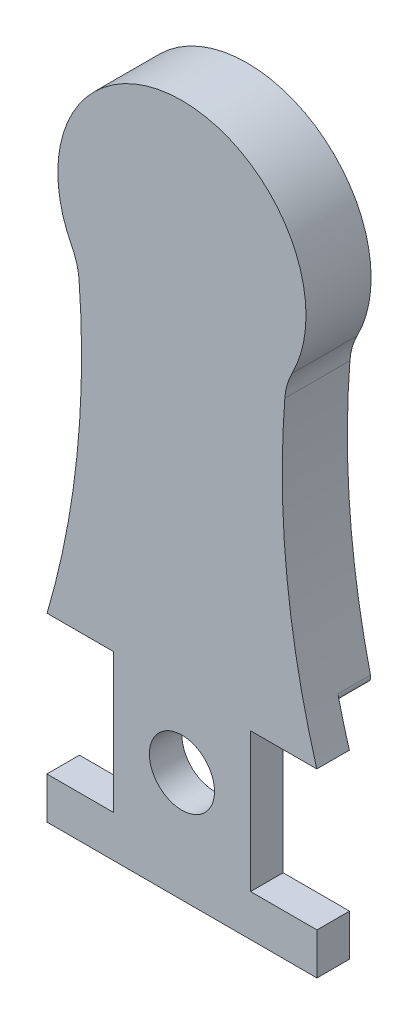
SolidWorks part; units mm, degrees
ref_plane "Front Plane" through (0, 0, 0) normal (0, 0, 1) x (1, 0, 0)
ref_plane "Top Plane" through (0, 0, 0) normal (0, 1, 0) x (1, 0, 0)
ref_plane "Right Plane" through (0, 0, 0) normal (1, 0, 0) x (0, 0, -1)
sketch "Sketch1" plane through (0, 0, 0) normal (0, 0, 1) x (1, 0, 0)
  line L0 (0, 0) -> (0, 60) construction
  line L1 (-53.033, -53.033) -> (0, 0) construction
  line L2 (0, 60) -> (16, 60) construction
  line L3 (0, 60) -> (0, 50) construction
  line L4 (0, 60) -> (-16, 60) construction
  line L5 (0, 0) -> (0, -95.7808) construction
  line L6 (0, 0) -> (53.033, -53.033) construction
  line L8 (-64.561, -58.9899) -> (67.8775, -58.9899) construction
  line L9 (-20.9932, 10.8458) -> (-10.5429, 10.8458) construction
  line L10 (-10.5429, 10.8458) -> (-10.5429, -10.5429) construction
  line L11 (-10.5429, -10.5429) -> (-20.7412, -10.5429) construction
  line L12 (-20.7412, -10.5429) -> (-20.7412, -16.9424) construction
  line L13 (20.7412, -10.5429) -> (20.7412, -16.9424) construction
  line L14 (10.5429, -10.5429) -> (20.7412, -10.5429) construction
  line L15 (10.5429, 10.8458) -> (10.5429, -10.5429) construction
  line L16 (20.9932, 10.8458) -> (10.5429, 10.8458) construction
  line L17 (-20.7412, -16.9424) -> (20.7412, -16.9424) construction
  line L18 (-63.2289, -53.033) -> (63.2289, -53.033) construction
  line L19 (0, 0) -> (-57.4533, -48.2091) construction
  line L20 (0, 0) -> (57.4533, -48.2091) construction
  circle A0 centre (0, 0) radius 5 construction
  arc A1 (-57.4533, -48.2091) -> (-16, 60) centre (-145.6998, 47.6415) ccw
  arc A2 (57.4533, -48.2091) -> (16, 60) centre (145.6998, 47.6415) cw
  arc A3 (-16, 60) -> (16, 60) centre (0, 70.3554) cw
  arc A5 (57.4533, -48.2091) -> (-57.4533, -48.2091) centre (0, 0) cw
  point P20 (0, -106.066)
  dimension "D1" = 10
  dimension "D2" = 75
  dimension "D3" = 60
  dimension "D4" = 5
  dimension "D5" = 5
  dimension "D6" = 41.4824
  dimension "D7" = 21.3887
  dimension "D8" = 6.3996
  dimension "D9" = 21.0858
  dimension "D10" = 6.3995
extrude "Body" add sketch "Sketch1" along normal blind 10
sketch "Sketch2" plane through (0, 0, 10) normal (0, 0, 1) x (1, 0, 0)
  circle A0 centre (0, 0) radius 5
  dimension "D1" = 10
extrude "Attachment Hole" cut sketch "Sketch2" against normal through all
sketch "Sketch17" plane through (0, 0, 10) normal (0, 0, 1) x (1, 0, 0)
  line L0 (-20.9932, 10.8458) -> (-10.5429, 10.8458)
  line L1 (-10.5429, 10.8458) -> (-10.5429, -10.5429)
  line L2 (-10.5429, -10.5429) -> (-20.7412, -10.5429)
  line L3 (-20.7412, -10.5429) -> (-20.7412, -16.9424)
  line L4 (-20.7412, -16.9424) -> (20.7412, -16.9424)
  line L5 (20.7412, -16.9424) -> (20.7412, -10.5429)
  line L6 (20.7412, -10.5429) -> (10.5429, -10.5429)
  line L7 (10.5429, -10.5429) -> (10.5429, 10.8458)
  line L8 (10.5429, 10.8458) -> (20.9932, 10.8458)
  line L9 (0, 0) -> (0, 42.2888) construction
  line L10 (0, 0) -> (0, 60) construction
  line L11 (0, 36.1313) -> (0, -16.9424) construction
  arc A0 (-20.9932, 10.8458) -> (-20.1377, 12.8717) centre (-168.3354, 74.256) ccw
  arc A2 (20.9932, 10.8458) -> (20.1377, 12.8717) centre (168.3354, 74.256) cw
  arc A3 (-20.1377, 12.8717) -> (20.1377, 12.8717) centre (0, 0) cw
  arc A4 (16, 60) -> (57.4533, -48.2091) centre (145.6998, 47.6415) ccw construction
  dimension "D2" = 23.9
  dimension "D1" = 53.0738
sketch "Sketch34" plane through (0, 0, 10) normal (0, 0, 1) x (1, 0, 0)
  line L0 (-20.9932, 10.8458) -> (-10.5429, 10.8458)
  line L1 (-10.5429, 10.8458) -> (-10.5429, -10.5429)
  line L2 (-10.5429, -10.5429) -> (-20.7412, -10.5429)
  line L3 (-20.7412, -10.5429) -> (-20.7412, -16.9424)
  line L4 (-20.7412, -16.9424) -> (20.7412, -16.9424)
  line L5 (20.7412, -16.9424) -> (20.7412, -10.5429)
  line L6 (20.7412, -10.5429) -> (10.5429, -10.5429)
  line L7 (10.5429, -10.5429) -> (10.5429, 10.8458)
  line L8 (10.5429, 10.8458) -> (20.9932, 10.8458)
  arc A0 (-20.9932, 10.8458) -> (-57.4533, -48.2091) centre (-148.4496, 48.754) cw
  arc A1 (-57.4533, -48.2091) -> (57.4533, -48.2091) centre (0, 0) ccw
  arc A2 (57.4533, -48.2091) -> (20.9932, 10.8458) centre (209.9801, 86.7426) cw
extrude "Cut-Extrude28" cut sketch "Sketch34" against normal through all
sketch "Sketch35" plane through (0, 0, 0) normal (0, 0, -1) x (-1, 0, 0)
  line L0 (20.9932, 10.8458) -> (10.5429, 10.8458)
  line L1 (10.5429, 10.8458) -> (10.5429, -10.5429)
  line L2 (10.5429, -10.5429) -> (20.7412, -10.5429)
  line L3 (20.7412, -10.5429) -> (20.7412, -16.9424)
  line L4 (20.7412, -16.9424) -> (-20.7412, -16.9424)
  line L5 (-20.7412, -16.9424) -> (-20.7412, -10.5429)
  line L6 (-20.7412, -10.5429) -> (-10.5429, -10.5429)
  line L7 (-10.5429, -10.5429) -> (-10.5429, 10.8458)
  line L8 (-10.5429, 10.8458) -> (-20.9932, 10.8458)
  arc A0 (-20.1377, 12.8717) -> (20.1377, 12.8717) centre (0, 0) cw
  arc A1 (-20.9932, 10.8458) -> (-20.1377, 12.8717) centre (-171.8915, 75.7576) ccw
  arc A2 (20.1377, 12.8717) -> (20.9932, 10.8458) centre (149.3848, 66.2539) ccw
  arc A3 (16, 60) -> (20.7164, 10.8458) centre (145.6998, 47.6415) ccw construction
  arc A4 (-20.7164, 10.8458) -> (-16, 60) centre (-145.6998, 47.6415) ccw construction
  dimension "D1" = 23.9
extrude "Cut-Extrude30" cut sketch "Sketch35" against normal blind 5
fillet "Fillet1" radius 10 1 edges at (16, 60, 5)
fillet "Fillet2" radius 10 1 edges at (-16, 60, 5)
fillet "Fillet5" radius 1 1 edges at (20.1377, 12.8717, 2.5)
fillet "Fillet6" radius 1 1 edges at (-20.1377, 12.8717, 2.5)
